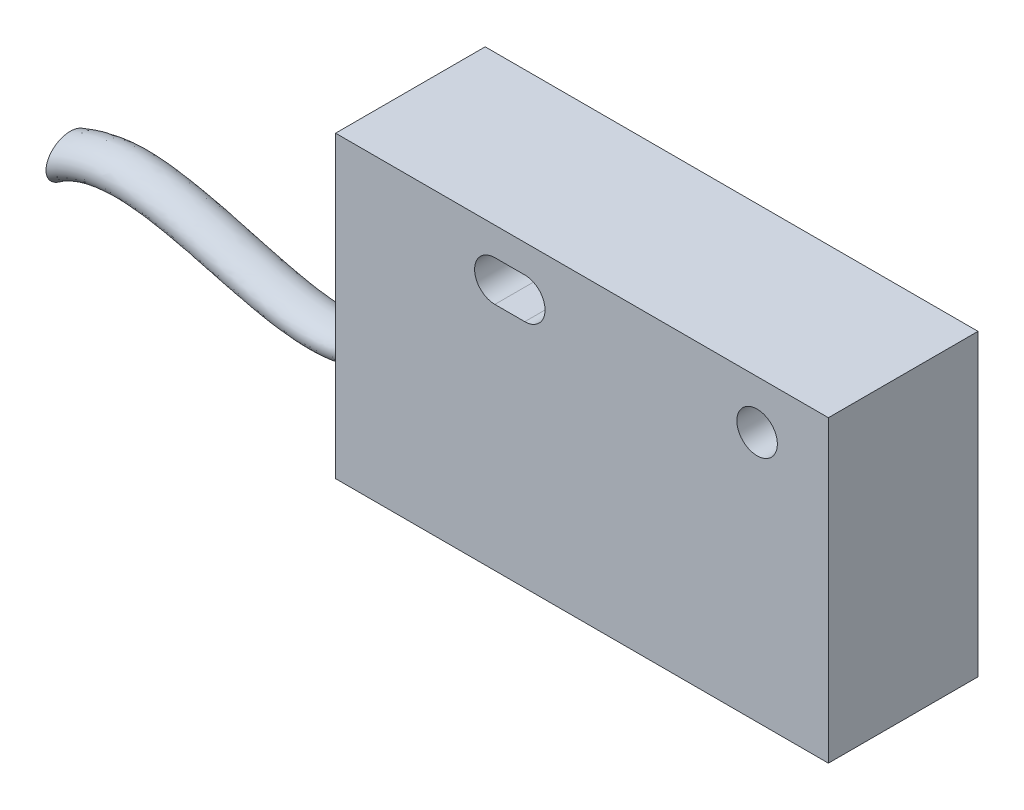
SolidWorks part; units mm, degrees
ref_plane "Plan de face" through (0, 0, 0) normal (0, 0, 1) x (1, 0, 0)
ref_plane "Plan de dessus" through (0, 0, 0) normal (0, 1, 0) x (1, 0, 0)
ref_plane "Plan de droite" through (0, 0, 0) normal (1, 0, 0) x (0, 0, -1)
sketch "Esquisse1" plane through (0, 0, 0) normal (0, 0, 1) x (1, 0, 0)
  line L0 (23.95, 14.25) -> (5.568, 14.25) construction
  line L1 (28, 17) -> (0, 17)
  line L2 (28, 17) -> (28, 0)
  line L3 (28, 0) -> (0, 0)
  line L4 (0, 17) -> (0, 0)
  line L5 (9.05, 14.25) -> (10.75, 14.25) construction
  line L6 (9.05, 15.4) -> (10.75, 15.4)
  line L7 (9.05, 13.1) -> (10.75, 13.1)
  circle A0 centre (23.95, 14.25) radius 1.15
  arc A1 (9.05, 15.4) -> (9.05, 13.1) centre (9.05, 14.25) ccw
  arc A2 (10.75, 13.1) -> (10.75, 15.4) centre (10.75, 14.25) ccw
  point P10 (9.9, 14.25)
  dimension "D3" = 2.3
  dimension "D4" = 22.8
  dimension "D5" = 1.6
  dimension "D6" = 4
  dimension "D7" = 7.9
  dimension "D1" = 28
  dimension "D2" = 17
extrude "Extrusion1" add sketch "Esquisse1" along normal mid plane 8.5
sketch "Esquisse2" plane through (0, 0, 0) normal (-1, 0, 0) x (0, 0, 1)
  line L0 (4.25, 0) -> (-4.25, 0) construction
  line L1 (0, 0) -> (0, 17) construction
  line L2 (4.25, 17) -> (-4.25, 17) construction
  circle A0 centre (0, 5) radius 1.25
  dimension "D1" = 5
  dimension "D2" = 2.5
sketch "Esquisse3" plane through (0, 0, 0) normal (0, 0, 1) x (1, 0, 0)
  line L0 (0, 6.25) -> (0, 3.75) construction
  line L1 (0, 0) -> (0, 17) construction
  spline S0 degree 3 poles (0, 3.75) (-5.6854, -1.359) (-14.0903, 6.8355) (-19.5711, 2.8234) knots 0 0 0 0 1 1 1 1
sweep "Balayage1" add profiles "Esquisse2" path "Esquisse3"
sketch "Esquisse4" plane through (0, 0, 0) normal (0, -1, 0) x (1, 0, 0)
  line L0 (28, 0) -> (13, 0) construction
  line L1 (28, 4.25) -> (28, -4.25) construction
  circle A0 centre (13, 0) radius 2.75
  circle A1 centre (21, 0) radius 1.75
  dimension "D1" = 3.5
  dimension "D2" = 5.5
  dimension "D3" = 7
  dimension "D4" = 15
extrude "Extrusion3" add sketch "Esquisse4" along normal blind 1
fillet "Congé1" radius 1 2 edges at (22.75, -1, 0) (15.75, -1, 0)
sketch "Esquisse5" plane through (28, 0, 0) normal (1, 0, 0) x (0, 0, -1)
  line L0 (0, 17) -> (0, -67.9728) construction
  line L1 (-4.25, 17) -> (4.25, 17) construction
